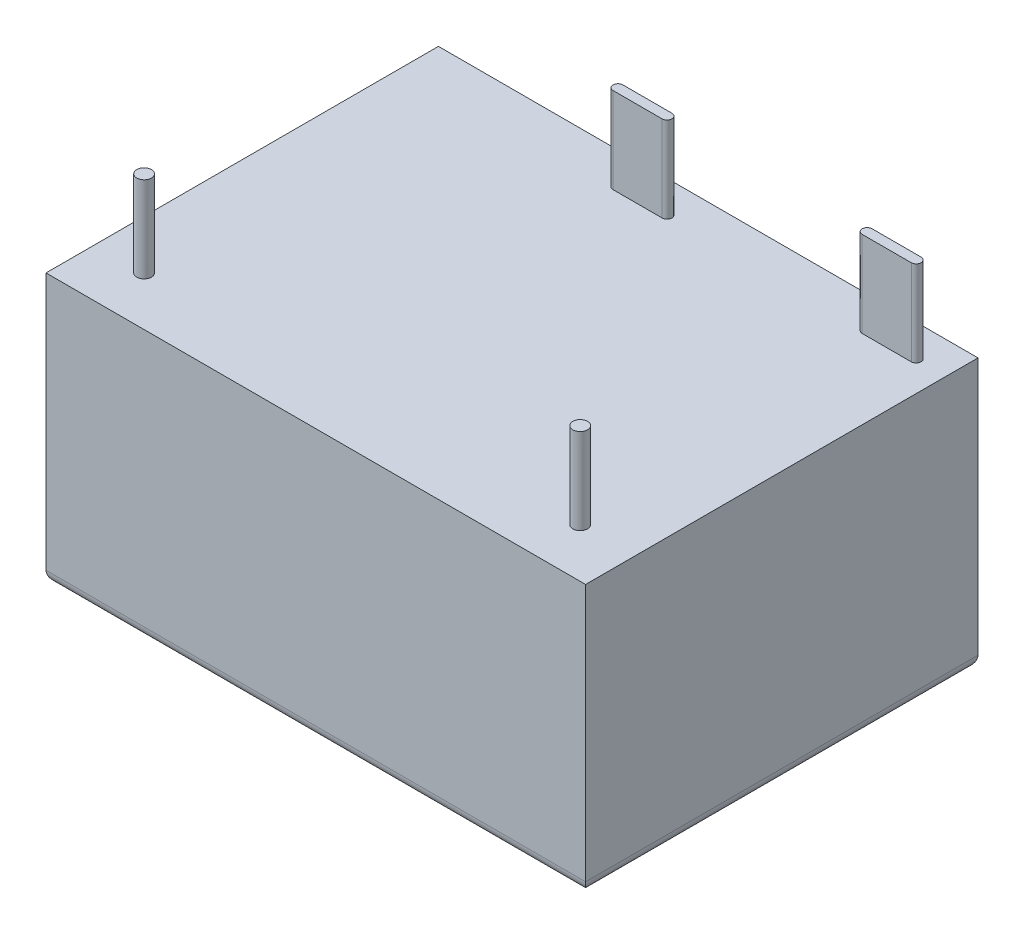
SolidWorks part; units mm, degrees
ref_plane "Front Plane" through (0, 0, 0) normal (0, 0, 1) x (1, 0, 0)
ref_plane "Top Plane" through (0, 0, 0) normal (0, 1, 0) x (1, 0, 0)
ref_plane "Right Plane" through (0, 0, 0) normal (1, 0, 0) x (0, 0, -1)
sketch "Sketch2" plane through (0, 0, 0) normal (0, 1, 0) x (1, 0, 0)
  line L1 (0, 0) -> (22, 0)
  line L2 (0, 0) -> (0, 16)
  line L3 (0, 16) -> (22, 16)
  line L4 (22, 0) -> (22, 16)
  dimension "D1" = 22
  dimension "D2" = 16
extrude "Boss-Extrude1" add sketch "Sketch2" along normal blind 11
sketch "Sketch3" plane through (0, 11, 0) normal (0, 1, 0) x (1, 0, 0)
  line L0 (0, 0) -> (22, 0) construction
  line L1 (0, 16) -> (0, 0) construction
  line L2 (22, 0) -> (22, 16) construction
  line L3 (0, 0) -> (22, 0) construction
  circle A0 centre (2, 2) radius 0.3
  circle A1 centre (19.78, 2) radius 0.3
  dimension "D4" = 2.22
  dimension "D2" = 2
  dimension "D3" = 2
  dimension "D5" = 2
  dimension "D1" = 2
extrude "Boss-Extrude2" add sketch "Sketch3" along normal blind 3.5
sketch "Sketch4" plane through (0, 11, 0) normal (0, 1, 0) x (1, 0, 0)
  line L0 (20.78, 14.7) -> (18.78, 14.7) construction
  line L1 (20.78, 14.5) -> (18.78, 14.5)
  line L2 (20.78, 14.9) -> (18.78, 14.9)
  line L3 (22, 0) -> (22, 16) construction
  line L5 (10.62, 14.7) -> (8.62, 14.7) construction
  line L6 (10.62, 14.5) -> (8.62, 14.5)
  line L7 (10.62, 14.9) -> (8.62, 14.9)
  arc A0 (20.78, 14.5) -> (20.78, 14.9) centre (20.78, 14.7) ccw
  arc A1 (18.78, 14.9) -> (18.78, 14.5) centre (18.78, 14.7) ccw
  arc A2 (10.62, 14.5) -> (10.62, 14.9) centre (10.62, 14.7) ccw
  arc A3 (8.62, 14.9) -> (8.62, 14.5) centre (8.62, 14.7) ccw
  circle A4 centre (19.78, 2) radius 0.3 construction
  point P2 (19.78, 14.7)
  point P14 (9.62, 14.7)
  dimension "D1" = 2.22
  dimension "D2" = 12.7
  dimension "D3" = 2
extrude "Boss-Extrude3" add sketch "Sketch4" along normal blind 3.5
fillet "Fillet2" radius 0.5 4 edges at (11, 0, 0) (22, 0, -8) (11, 0, -16) (0, 0, -8)
